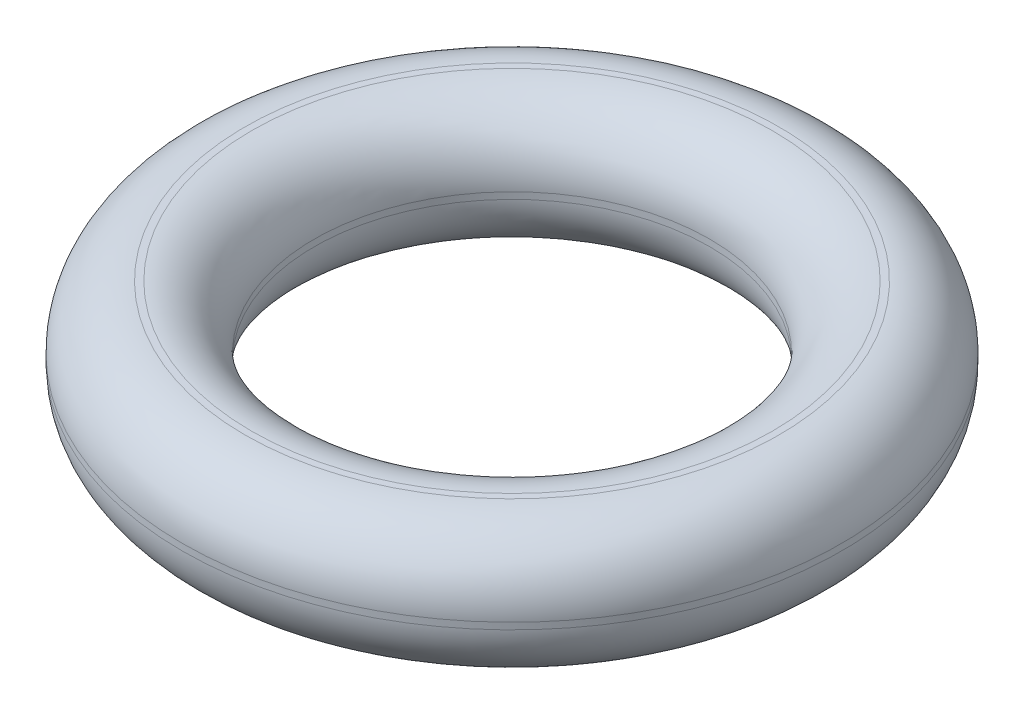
SolidWorks part; units mm, degrees
ref_plane "Front Plane" through (0, 0, 0) normal (0, 0, 1) x (1, 0, 0)
ref_plane "Top Plane" through (0, 0, 0) normal (0, 1, 0) x (1, 0, 0)
ref_plane "Right Plane" through (0, 0, 0) normal (1, 0, 0) x (0, 0, -1)
sketch "Sketch1" plane through (0, 0, 0) normal (0, 1, 0) x (1, 0, 0)
  circle A0 centre (0, 0) radius 1.5
  circle A1 centre (0, 0) radius 2.5
  dimension "D1" = 5
  dimension "D2" = 3
extrude "Boss-Extrude1" add sketch "Sketch1" along normal blind 1
fillet "Fillet1" radius 0.475 4 edges at (0, 0, 1.5) (0, 0, 2.5) (0, 1, 1.5) (0, 1, 2.5)
